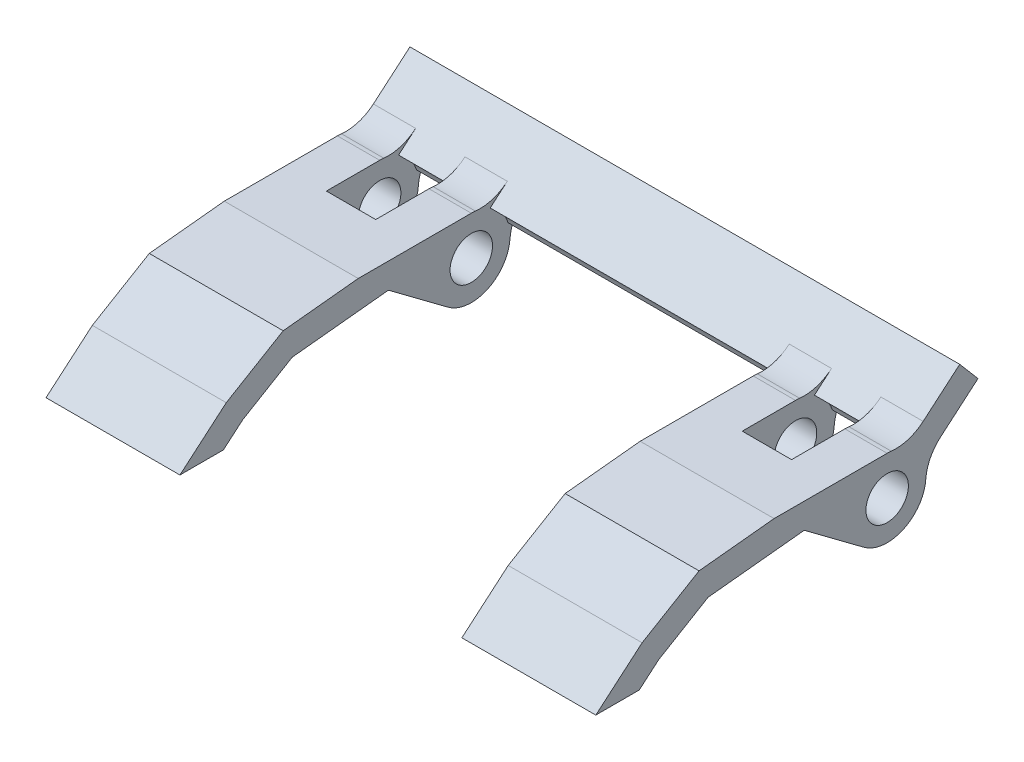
SolidWorks part; units mm, degrees
ref_plane "前视基准面" through (0, 0, 0) normal (0, 0, 1) x (1, 0, 0)
ref_plane "上视基准面" through (0, 0, 0) normal (0, 1, 0) x (1, 0, 0)
ref_plane "右视基准面" through (0, 0, 0) normal (1, 0, 0) x (0, 0, -1)
sketch "草图1" plane through (0, 0, 0) normal (0, 1, 0) x (1, 0, 0)
  line L1 (-45.5, -18) -> (45.5, -18)
  line L2 (-45.5, -18) -> (-45.5, 18)
  line L3 (-45.5, 18) -> (45.5, 18)
  line L4 (45.5, -18) -> (45.5, 18)
  line L5 (-45.5, -18) -> (45.5, 18) construction
  line L6 (-45.5, 18) -> (45.5, -18) construction
  point P0 (0, 0)
  dimension "D1" = 91
  dimension "D2" = 36
extrude "凸台-拉伸1" add sketch "草图1" along normal blind 17
shell "抽壳1" thickness 1.5
fillet "圆角1" radius 2.5 4 edges at (-45.5, 8.5, 18) (-45.5, 8.5, -18) (45.5, 8.5, 18) (45.5, 8.5, -18)
sketch "草图2" plane through (0, 1.5, 0) normal (0, 1, 0) x (1, 0, 0)
  line L1 (-36.25, -11.5) -> (36.25, -11.5)
  line L2 (-36.25, -11.5) -> (-36.25, 11.5)
  line L3 (-36.25, 11.5) -> (36.25, 11.5)
  line L4 (36.25, -11.5) -> (36.25, 11.5)
  line L5 (-36.25, -11.5) -> (36.25, 11.5) construction
  line L6 (-36.25, 11.5) -> (36.25, -11.5) construction
  point P0 (0, 0)
  dimension "D1" = 72.5
  dimension "D2" = 23
extrude "切除-拉伸1" cut sketch "草图2" against normal up to next
sketch "草图3" plane through (0, 1.5, 0) normal (0, 1, 0) x (1, 0, 0)
  line L0 (44, 16.5) -> (-44, 16.5) construction
  line L1 (-44, 16.5) -> (-44, -16.5) construction
  line L2 (-44, 16.5) -> (-41, 16.5)
  line L3 (-44, 16.5) -> (-44, 13.5)
  arc A0 (-44, 13.5) -> (-41, 16.5) centre (-41, 13.5) ccw
  dimension "D1" = 6
extrude "凸台-拉伸2" add sketch "草图3" along normal blind 6.5
mirror "镜向1" about plane through (0, 0, 0) normal (1, 0, 0) of "凸台-拉伸2"
mirror "镜向2" about plane through (0, 0, 0) normal (0, 0, 1) of "镜向1", "凸台-拉伸2"
sketch "草图4" plane through (45.5, 0, 0) normal (1, 0, 0) x (0, 0, -1)
  line L0 (-6.5, 15.5) -> (6.5, 15.5)
  line L1 (-6.5, 15.5) -> (-6.5, 8.5)
  line L2 (6.5, 15.5) -> (6.5, 8.5)
  line L3 (-6.5, 8.5) -> (6.5, 8.5)
  line L7 (-15.5, 17) -> (-15.5, 0) construction
  line L9 (-15.5, 17) -> (15.5, 17) construction
  dimension "D1" = 7
  dimension "D2" = 13
  dimension "D3" = 9
  dimension "D4" = 8.5
extrude "切除-拉伸2" cut sketch "草图4" against normal up to next
sketch "草图5" plane through (0, 17, 0) normal (0, 1, 0) x (1, 0, 0)
  line L0 (44, 16.5) -> (-44, 16.5) construction
  line L1 (-44, 16.5) -> (-44, -16.5) construction
  line L2 (-44, -16.5) -> (44, -16.5) construction
  line L3 (44, -16.5) -> (44, 16.5) construction
  line L4 (44, 16.5) -> (-44, 16.5) construction
  line L5 (-44, 16.5) -> (-44, -16.5) construction
  line L6 (-44, -16.5) -> (44, -16.5) construction
  line L7 (44, -16.5) -> (44, 16.5) construction
  line L8 (43.5, 16) -> (-43.5, 16)
  line L9 (-43.5, 16) -> (-43.5, -16)
  line L10 (-43.5, -16) -> (43.5, -16)
  line L11 (43.5, -16) -> (43.5, 16)
  dimension "D1" = 0.5
extrude "凸台-拉伸3" add sketch "草图5" along normal blind 1.5 separate body
sketch "草图6" plane through (0, 18.5, 0) normal (0, 1, 0) x (1, 0, 0)
  line L0 (-43.5, 16) -> (-43.5, -16) construction
  line L1 (-40.5, 9) -> (-37.5, 9)
  line L2 (-40.5, 9) -> (-40.5, -9)
  line L3 (-40.5, -9) -> (-37.5, -9)
  line L4 (-37.5, 9) -> (-37.5, -9)
  line L5 (-40.5, 9) -> (-37.5, -9) construction
  line L6 (-40.5, -9) -> (-37.5, 9) construction
  line L8 (-1000, 0) -> (49000, 0) construction
  point P0 (-39, 0)
  dimension "D1" = 3
  dimension "D2" = 18
  dimension "D3" = 3
extrude "切除-拉伸3" cut sketch "草图6" against normal blind 1.5
pattern_linear "阵列(线性)1" count 3 spacing 6 along (1, 0, 0) of "切除-拉伸3"
mirror "镜向3" about plane through (0, 0, 0) normal (1, 0, 0) of "阵列(线性)1", "切除-拉伸3"
ref_plane "基准面1" through (15, 0, 0) normal (1, 0, 0) x (0, 0, -1)
ref_plane "基准面2" through (-15, 0, 0) normal (1, 0, 0) x (0, 0, -1)
sketch "草图7" plane through (-15, 0, 0) normal (1, 0, 0) x (0, 0, -1)
  line L0 (6.4647, 22.5261) -> (4.9994, 18.5)
  line L2 (-16, 18.5) -> (16, 18.5) construction
  line L3 (12.2838, 21.5) -> (12.2838, 18.5)
  line L4 (4.9994, 18.5) -> (12.2838, 18.5)
  arc A0 (12.2838, 21.5) -> (6.4647, 22.5261) centre (9.2838, 21.5) ccw
  dimension "D3" = 6
  dimension "D1" = 70
  dimension "D2" = 3
extrude "凸台-拉伸4" add sketch "草图7" along normal mid plane 3
sketch "草图8" plane through (-13.5, 0, 0) normal (1, 0, 0) x (0, 0, -1)
  circle A0 centre (9.2838, 21.5) radius 1.5
  dimension "D1" = 3
extrude "切除-拉伸4" cut sketch "草图8" against normal up to next (3 mm away)
mirror "镜向4" about plane through (0, 0, 0) normal (1, 0, 0) of "切除-拉伸4", "凸台-拉伸4"
sketch "草图9" plane through (0, 17, 0) normal (0, 1, 0) x (1, 0, 0)
  line L0 (43, 18) -> (-43, 18) construction
  line L1 (-45.5, -18) -> (45.5, -18)
  line L2 (-45.5, -18) -> (-45.5, 18)
  line L3 (-45.5, 18) -> (45.5, 18)
  line L4 (45.5, -18) -> (45.5, 18)
  line L5 (-45.5, -18) -> (45.5, 18) construction
  line L6 (-45.5, 18) -> (45.5, -18) construction
  line L7 (45.5, -15.5) -> (45.5, 15.5) construction
  point P0 (0, 0)
extrude "切除-拉伸5" cut sketch "草图9" against normal up to next
sketch "草图10" plane through (43.5, 0, 0) normal (1, 0, 0) x (0, 0, -1)
  line L0 (10.6303, 23.901) -> (14.4363, 27.1436)
  line L1 (14.4363, 27.1436) -> (15.7334, 25.6212)
  line L2 (15.7334, 25.6212) -> (11.9025, 22.3574)
  line L4 (-11.3808, 18.5) -> (-8.0932, 21.3011)
  line L5 (-16, 18.5) -> (16, 18.5) construction
  line L6 (-8.0932, 21.3011) -> (-4.055, 23.6999)
  line L7 (-4.055, 23.6999) -> (1.2673, 24.25)
  line L8 (-4.055, 23.6999) -> (3.3014, 24.4602) construction
  line L9 (-8.297, 18.5) -> (-6.9256, 19.6685)
  line L10 (-6.9256, 19.6685) -> (-3.4118, 21.7558)
  line L11 (-3.4118, 21.7558) -> (3.4083, 22.4606)
  line L12 (3.4083, 22.4606) -> (7.6438, 19.2968)
  line L13 (-11.3808, 18.5) -> (-8.297, 18.5)
  line L14 (-10.0837, 16.9776) -> (-6.9256, 19.6685) construction
  line L15 (9.2896, 24.25) -> (1.2673, 24.25)
  line L18 (3.4083, 22.4606) -> (9.5956, 22.4846) construction
  line L20 (3.3014, 24.4602) -> (9.5879, 24.4846) construction
  arc A5 (7.6438, 19.2968) -> (11.9025, 22.3574) centre (9.2896, 21.5) ccw
  circle A6 centre (9.2896, 21.5) radius 1.5058
  arc A7 (10.6303, 23.901) -> (9.2896, 24.25) centre (9.2896, 21.5) ccw
  dimension "D2" = 5.5
  dimension "D3" = 5
  dimension "D4" = 40.432
  dimension "D5" = 40.43
  dimension "D6" = 2
  dimension "D1" = 2
extrude "凸台-拉伸5" add sketch "草图10" along normal blind 39 separate body
sketch "草图11" plane through (0, 18.5, 0) normal (0, -1, 0) x (1, 0, 0)
  line L0 (46.5, 11.3808) -> (46.5, -12.0396)
  line L1 (46.5, 11.3808) -> (50, 11.3808)
  line L2 (46.5, -12.0396) -> (50, -12.0396)
  line L3 (50, 11.3808) -> (50, -12.0396)
  line L4 (82.5, 11.3808) -> (43.5, 11.3808) construction
  line L5 (43.5, -12.0396) -> (82.5, -12.0396) construction
  line L6 (53, 11.3808) -> (73, 11.3808)
  line L7 (53, 11.3808) -> (53, -12.0396)
  line L8 (73, 11.3808) -> (73, -12.0396)
  line L9 (53, -12.0396) -> (73, -12.0396)
  line L10 (76, 11.3808) -> (76, -12.0396)
  line L11 (76, 11.3808) -> (79.5, 11.3808)
  line L12 (76, -12.0396) -> (79.5, -12.0396)
  line L13 (79.5, 11.3808) -> (79.5, -12.0396)
  line L14 (43.5, 16) -> (43.5, -16) construction
  line L16 (82.5, -3.4083) -> (82.5, -7.6438) construction
  line L18 (43.5, -12.0396) -> (82.5, -12.0396) construction
  dimension "D1" = 3.5
  dimension "D2" = 3.5
  dimension "D3" = 3
  dimension "D4" = 3
  dimension "D5" = 3
  dimension "D6" = 3
extrude "切除-拉伸6" cut sketch "草图11" against normal up to next
sketch "草图13" plane through (82.5, 0, 0) normal (1, 0, 0) x (0, 0, -1)
  line L0 (12.0396, 25.1017) -> (10.6303, 23.901) construction
  line L1 (12.0396, 25.1017) -> (12.0396, 22.4742) construction
  line L2 (12.0396, 25.1017) -> (10.6303, 23.901)
  line L3 (12.0396, 25.1017) -> (12.0396, 22.4742)
  line L4 (12.0396, 22.4742) -> (11.9025, 22.3574)
  line L6 (-3.4118, 21.7558) -> (3.4083, 22.4606) construction
  line L8 (-3.4118, 21.7558) -> (3.4083, 22.4606)
  line L9 (-6.9256, 19.6685) -> (-3.4118, 21.7558) construction
  line L10 (-8.297, 18.5) -> (-6.9256, 19.6685) construction
  line L11 (-11.3808, 18.5) -> (-8.297, 18.5) construction
  line L12 (-8.0932, 21.3011) -> (-11.3808, 18.5) construction
  line L13 (-4.055, 23.6999) -> (-8.0932, 21.3011) construction
  line L14 (1.2673, 24.25) -> (-4.055, 23.6999) construction
  line L15 (9.2896, 24.25) -> (1.2673, 24.25) construction
  line L16 (-6.9256, 19.6685) -> (-3.4118, 21.7558)
  line L17 (-8.297, 18.5) -> (-6.9256, 19.6685)
  line L18 (-11.3808, 18.5) -> (-8.297, 18.5)
  line L19 (-8.0932, 21.3011) -> (-11.3808, 18.5)
  line L20 (-4.055, 23.6999) -> (-8.0932, 21.3011)
  line L21 (1.2673, 24.25) -> (-4.055, 23.6999)
  line L22 (5.5084, 24.25) -> (1.2673, 24.25)
  line L23 (3.4083, 22.4606) -> (5.5084, 24.25)
  arc A4 (11.9025, 22.3574) -> (10.6303, 23.901) centre (9.2896, 21.5) ccw
extrude "凸台-拉伸6" add sketch "草图13" against normal blind 39
sketch "草图14" plane through (0, 18.5, 0) normal (0, -1, 0) x (1, 0, 0)
  line L0 (53, -5.5261) -> (73, -5.5261)
  line L1 (53, -5.5261) -> (53, 14.384)
  line L2 (73, -5.5261) -> (73, 14.384)
  line L3 (53, 14.384) -> (73, 14.384)
  line L4 (53, -3.4083) -> (53, -7.6438) construction
  line L5 (73, -7.6438) -> (73, -3.4083) construction
extrude "切除-拉伸7" cut sketch "草图14" against normal blind 39
sketch "草图15" plane through (43.5, 0, 0) normal (-1, 0, 0) x (0, 0, 1)
  line L0 (-16, 17) -> (16, 17)
  line L1 (-16, 17) -> (-16, 25.7454)
  line L2 (16, 17) -> (16, 25.7454)
  line L3 (-16, 25.7454) -> (16, 25.7454)
  line L4 (-16, 17) -> (16, 17) construction
extrude "切除-拉伸8" cut sketch "草图15" along normal up to next
fillet "圆角4" radius 3 8 edges at (74.5, 23.901, -10.6303) (74.5, 22.3574, -11.9025) (81, 23.901, -10.6303) (81, 22.3574, -11.9025) (45, 23.901, -10.6303) (45, 22.3574, -11.9025) (51.5, 23.901, -10.6303) (51.5, 22.3574, -11.9025)
